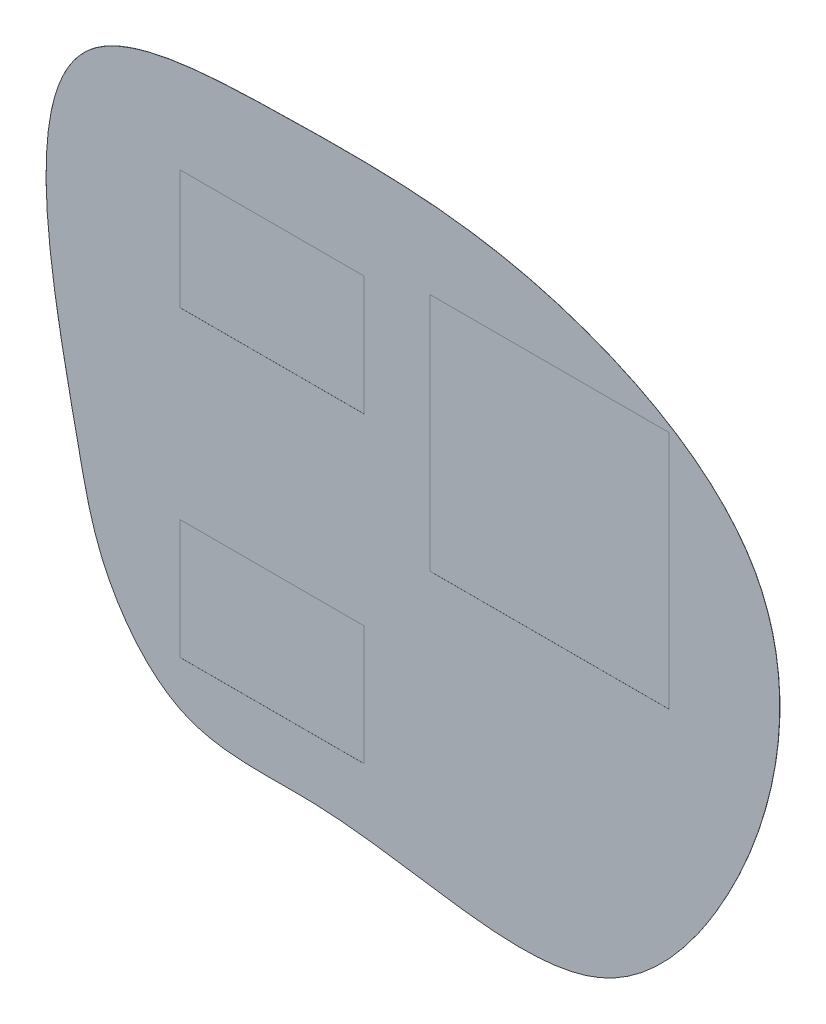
SolidWorks part; units mm, degrees
ref_plane "Plan de face" through (0, 0, 0) normal (0, 0, 1) x (1, 0, 0)
ref_plane "Plan de dessus" through (0, 0, 0) normal (0, 1, 0) x (1, 0, 0)
ref_plane "Plan de droite" through (0, 0, 0) normal (1, 0, 0) x (0, 0, -1)
sketch "Esquisse1" plane through (0, 0, 0) normal (0, 0, 1) x (1, 0, 0)
  spline S0 degree 3 poles (3432.281, 524.4624) (2321.5752, -4450.1635) (-775.5213, -7962.4109) (-4371.4954, -6612.8799) (-7626.7601, -7043.7856) (-8971.4856, -5229.6504) (-9568.1805, -2273.4784) (-10747.0105, 2849.9619) (-5225.4691, 3046.1168) (-1543.9561, 3047.4292) (3432.281, 524.4624) (2321.5752, -4450.1635) (-775.5213, -7962.4109) knots -0.385827 -0.259692 -0.14752 0 0.073918 0.206079 0.268813 0.324371 0.365015 0.527066 0.614173 0.740308 0.85248 1 1.073918 1.206079 1.268813 only from (1542.9476, -5058.3879) to (1542.9476, -5058.3879)
extrude "Boss.-Extru.1" add sketch "Esquisse1" against normal blind 2
sketch "Esquisse2" plane through (0, 0, 0) normal (0, 0, 1) x (1, 0, 0)
  line L1 (-4440.8767, -5856.1488) -> (-7576.5013, -5856.1488)
  line L2 (-4440.8767, -5856.1488) -> (-4440.8767, -3823.3701)
  line L3 (-4440.8767, -3823.3701) -> (-7576.5013, -3823.3701)
  line L4 (-7576.5013, -5856.1488) -> (-7576.5013, -3823.3701)
  line L5 (-4440.8767, 1333.2238) -> (-7576.5013, 1333.2238)
  line L6 (-4440.8767, 1333.2238) -> (-4440.8767, -699.5548)
  line L7 (-4440.8767, -699.5548) -> (-7576.5013, -699.5548)
  line L8 (-7576.5013, 1333.2238) -> (-7576.5013, -699.5548)
  line L9 (751.2574, -2457.2075) -> (-3319.0473, -2457.2075)
  line L10 (751.2574, -2457.2075) -> (751.2574, 1622.3061)
  line L11 (751.2574, 1622.3061) -> (-3319.0473, 1622.3061)
  line L12 (-3319.0473, -2457.2075) -> (-3319.0473, 1622.3061)
extrude "Enlèv. mat.-Extru.1" cut sketch "Esquisse2" against normal blind 1
